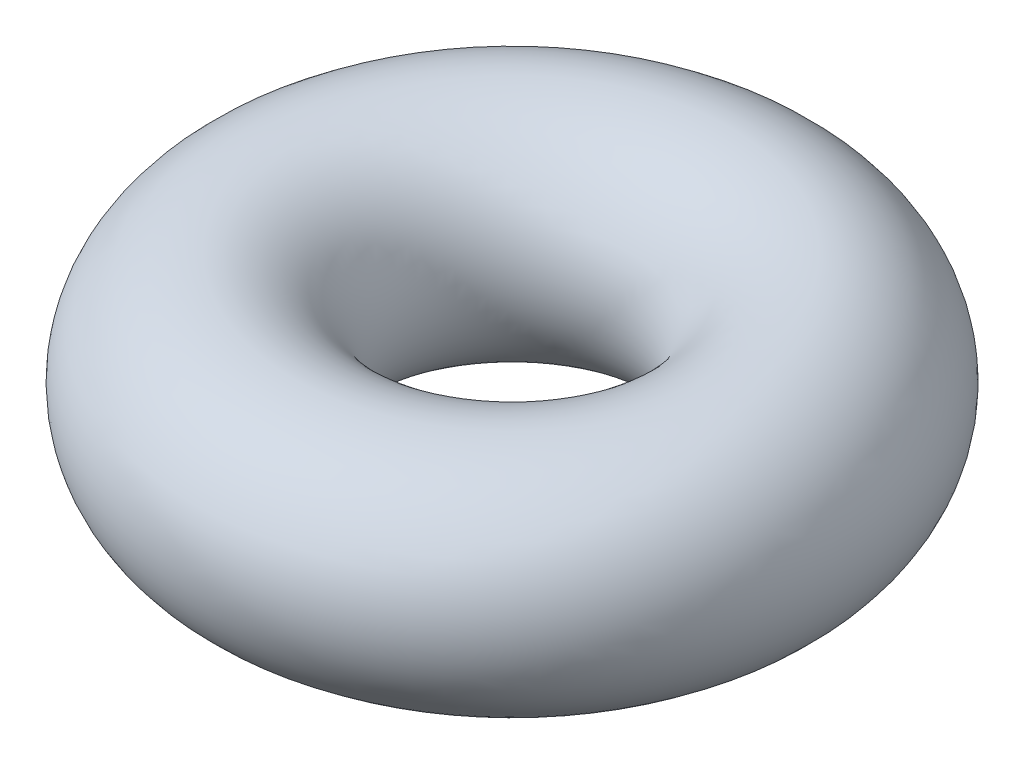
SolidWorks part; units mm, degrees
ref_plane "Front Plane" through (0, 0, 0) normal (0, 0, 1) x (1, 0, 0)
ref_plane "Top Plane" through (0, 0, 0) normal (0, 1, 0) x (1, 0, 0)
ref_plane "Right Plane" through (0, 0, 0) normal (1, 0, 0) x (0, 0, -1)
sketch "Sketch1" plane through (0, 0, 0) normal (0, 0, 1) x (1, 0, 0)
  line L0 (141.5301, 68.527) -> (141.5301, -63.572)
  circle A0 centre (0, 0) radius 62.5
  dimension "D1" = 125
revolve "Revolve-Thin1" add sketch "Sketch1" angle 360 about L0
